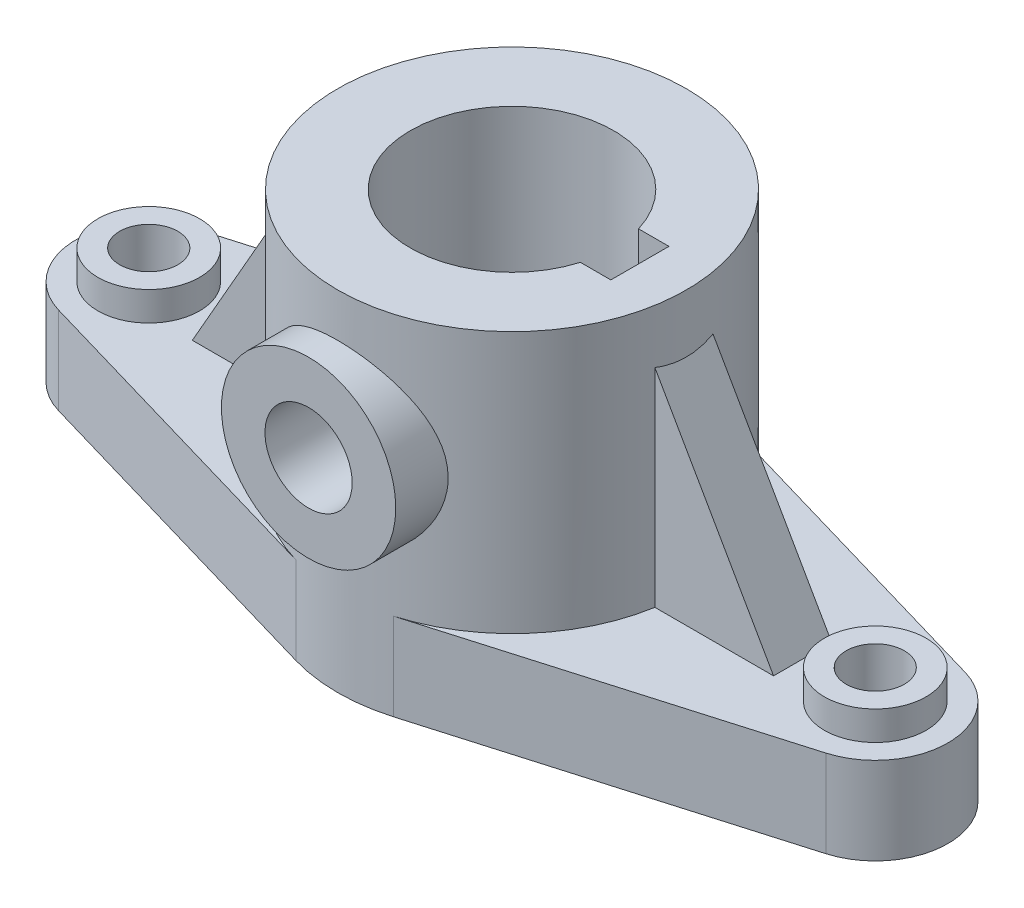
SolidWorks part; units mm, degrees
ref_plane "前视基准面" through (0, 0, 0) normal (0, 0, 1) x (1, 0, 0)
ref_plane "上视基准面" through (0, 0, 0) normal (0, 1, 0) x (1, 0, 0)
ref_plane "右视基准面" through (0, 0, 0) normal (1, 0, 0) x (0, 0, -1)
sketch "草图1" plane through (0, 0, 0) normal (0, 1, 0) x (1, 0, 0)
  line L0 (0, 0) -> (111.198, 0) construction
  line L1 (111.198, 0) -> (0, 0) construction
  line L2 (0, 0) -> (0, 107.1836) construction
  line L3 (3.36, 11.52) -> (26.4, 4.8)
  line L4 (3.36, -11.52) -> (26.4, -4.8)
  line L5 (-3.36, -11.52) -> (-26.4, -4.8)
  line L6 (-3.36, 11.52) -> (-26.4, 4.8)
  arc A0 (26.4, -4.8) -> (26.4, 4.8) centre (25, 0) ccw
  circle A1 centre (25, 0) radius 2
  arc A3 (3.36, 11.52) -> (-3.36, 11.52) centre (0, 0) ccw
  circle A5 centre (-25, 0) radius 2
  arc A6 (-26.4, -4.8) -> (-26.4, 4.8) centre (-25, 0) cw
  arc A7 (-3.36, -11.52) -> (3.36, -11.52) centre (0, 0) ccw
  circle A8 centre (0, 0) radius 7
  dimension "D1" = 25
extrude "拉伸1" add sketch "草图1" along normal blind 6
sketch "草图2" plane through (0, 6, 0) normal (0, 1, 0) x (1, 0, 0)
  circle A0 centre (25, 0) radius 3.5
  circle A1 centre (-25, 0) radius 3.5
  circle A2 centre (-25, 0) radius 2
  circle A3 centre (25, 0) radius 2
extrude "拉伸2" add sketch "草图2" along normal blind 2
sketch "草图3" plane through (0, 6, 0) normal (0, 1, 0) x (1, 0, 0)
  circle A0 centre (0, 0) radius 7
  circle A1 centre (0, 0) radius 12
extrude "拉伸3" add sketch "草图3" along normal blind 18
sketch "草图4" plane through (0, 24, 0) normal (0, 1, 0) x (1, 0, 0)
  line L0 (0, 0) -> (31.8008, 0) construction
  line L1 (6.7082, 2) -> (8.8023, 2)
  line L2 (8.8023, 2) -> (8.8023, -2)
  line L3 (8.8023, -2) -> (6.7082, -2)
  circle A0 centre (0, 0) radius 7 construction
  arc A1 (6.7082, -2) -> (6.7082, 2) centre (0, 0) ccw
extrude "切除-拉伸1" cut sketch "草图4" against normal through all
ref_plane "基准面1" through (0, 0, 14) normal (0, 0, 1) x (1, 0, 0)
sketch "草图5" plane through (0, 0, 14) normal (0, 0, 1) x (1, 0, 0)
  circle A0 centre (0, 15) radius 3
  circle A1 centre (0, 15) radius 6
extrude "拉伸4" add sketch "草图5" against normal up to next
sketch "草图6" plane through (0, 0, 14) normal (0, 0, 1) x (1, 0, 0)
  circle A0 centre (0, 15) radius 3
extrude "切除-拉伸2" cut sketch "草图6" against normal blind 18
sketch "草图7" plane through (0, 0, 0) normal (0, 0, 1) x (1, 0, 0)
  line L0 (-12, 20) -> (-20, 6)
  line L1 (-12, 24) -> (-12, 6) construction
  line L2 (-26.4, 6) -> (-3.36, 6) construction
rib "筋1" sketch "草图7" sketch "草图7" thickness 4 extrusion direction parallel to sketch draft on no parameters "D1"=4
mirror "镜向1" about plane through (0, 0, 0) normal (1, 0, 0) of "筋1"
